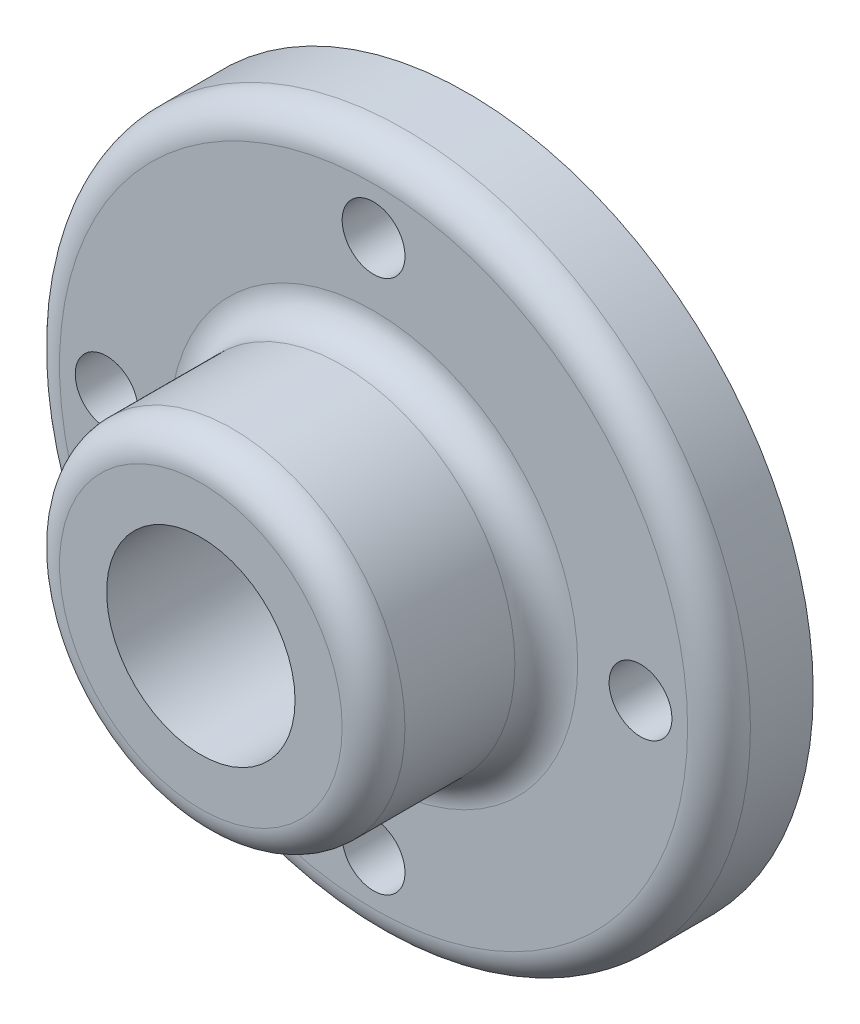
SolidWorks part; units mm, degrees
ref_plane "Front Plane" through (0, 0, 0) normal (0, 0, 1) x (1, 0, 0)
ref_plane "Top Plane" through (0, 0, 0) normal (0, 1, 0) x (1, 0, 0)
ref_plane "Right Plane" through (0, 0, 0) normal (1, 0, 0) x (0, 0, -1)
sketch "Sketch1" plane through (0, 0, 0) normal (0, 1, 0) x (1, 0, 0)
  line L0 (0, 0) -> (0, 59.8046) construction
  line L1 (0, 0) -> (69.85, 0)
  line L2 (69.85, 0) -> (69.85, -19.05)
  line L3 (69.85, -19.05) -> (34.925, -19.05)
  line L4 (34.925, -19.05) -> (34.925, -53.975)
  line L5 (34.925, -53.975) -> (0, -53.975)
  line L6 (0, -53.975) -> (0, 0)
  dimension "D1" = 139.7
  dimension "D2" = 69.85
  dimension "D3" = 53.975
  dimension "D4" = 19.05
revolve "Revolve1" add sketch "Sketch1" angle 360 about L0
sketch "Sketch2" plane through (0, 0, 53.975) normal (0, 0, 1) x (1, 0, 0)
  circle A0 centre (0, 0) radius 19.05
  dimension "D1" = 38.1
extrude "Cut-Extrude1" cut sketch "Sketch2" against normal through all
fillet "Fillet1" radius 6.35 3 edges at (69.85, 0, 19.05) (34.925, 0, 19.05) (34.925, 0, 53.975)
sketch "Sketch3" plane through (0, 0, 19.05) normal (0, 0, 1) x (1, 0, 0)
  line L0 (0, 0) -> (0, 74.1647) construction
  circle A0 centre (0, 0) radius 53.975 construction
  circle A1 centre (0, 53.975) radius 6.35
  dimension "D1" = 107.95
  dimension "D2" = 12.7
extrude "Cut-Extrude2" cut sketch "Sketch3" against normal through all
pattern_circular "CirPattern1" count 4 over 360 about axis through (0, 0, 0) along (0, 0, 1) of "Cut-Extrude2"
